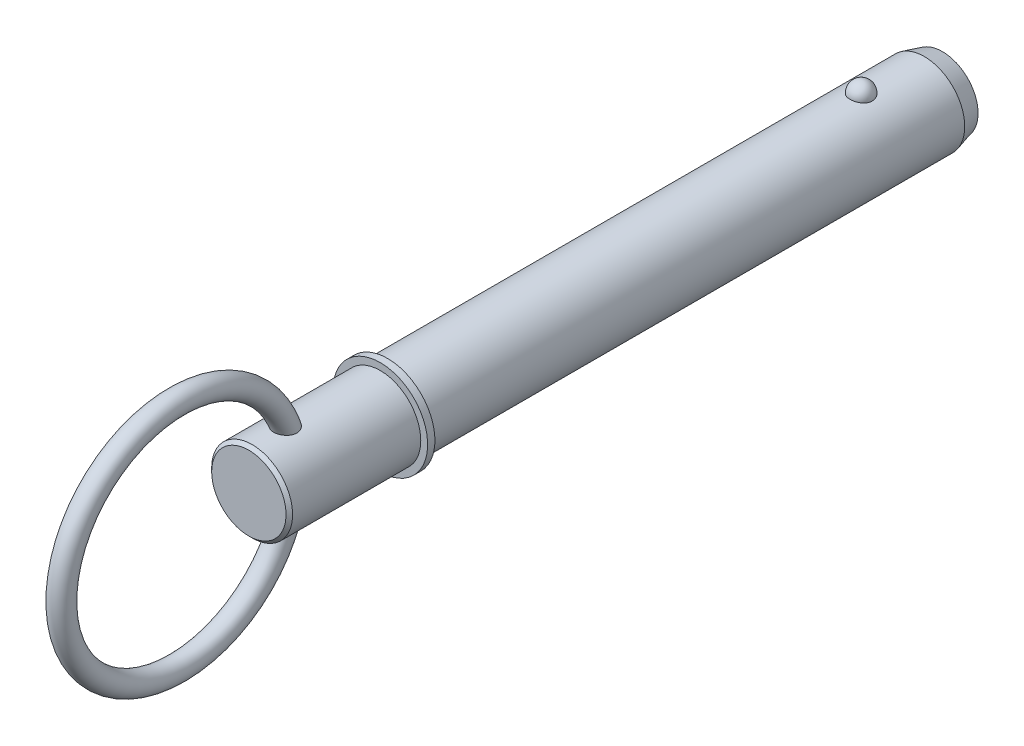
SolidWorks part; units mm, degrees
ref_plane "Front Plane" through (0, 0, 0) normal (0, 0, 1) x (1, 0, 0)
ref_plane "Top Plane" through (0, 0, 0) normal (0, 1, 0) x (1, 0, 0)
ref_plane "Right Plane" through (0, 0, 0) normal (1, 0, 0) x (0, 0, -1)
sketch "Sketch2" plane through (0, 0, 0) normal (0, 0, 1) x (1, 0, 0)
  circle A0 centre (0, 0) radius 11.115
  point P3 (0, 11.115)
  dimension "D1" = 22.23
extrude "Boss-Extrude1" add sketch "Sketch2" along normal blind 127
sketch "Sketch3" plane through (0, 0, 0) normal (0, 0, -1) x (-1, 0, 0)
  circle A0 centre (0, 0) radius 11.115
  dimension "D1" = 22.23
extrude "Boss-Extrude2" add sketch "Sketch3" along normal blind 25.4
chamfer "Chamfer1" distance 5 angle 15 1 edges at (-11.115, 0, -25.4)
sketch "Sketch18" plane through (0, 0, 0) normal (1, 0, 0) x (0, 0, -1)
  line L0 (20.4, 11.115) -> (-127, 11.115) construction
  line L1 (3.07, 14.185) -> (3.07, 8.045)
  line L2 (-127, -11.115) -> (20.4, -11.115) construction
  arc A0 (3.07, 14.185) -> (3.07, 8.045) centre (3.07, 11.115) ccw
  point P4 (0, 11.115)
  dimension "D1" = 25.3
revolve "Revolve1" add sketch "Sketch18" angle 360 about L1
sketch "Sketch19" plane through (0, 0, 0) normal (1, 0, 0) x (0, 0, -1)
  line L0 (-33.7288, 0) -> (-46.4542, 0) construction
sketch "Sketch20" plane through (0, 0, 0) normal (1, 0, 0) x (0, 0, -1)
  line L0 (-127, 0) -> (-127, 13)
  line L1 (-127, 11.115) -> (-127, -11.115) construction
  line L2 (-127, 13) -> (-129, 13)
  line L3 (-129, 13) -> (-129, 0)
  line L4 (-33.7288, 0) -> (-46.4542, 0) construction
  line L5 (-129, 0) -> (-127, 0)
  dimension "D1" = 13
  dimension "D2" = 2
revolve "Revolve2" add sketch "Sketch20" angle 360 about L0
sketch "Sketch21" plane through (0, 0, 127) normal (0, 0, -1) x (-1, 0, 0)
  circle A0 centre (0, 0) radius 11.115
  dimension "D1" = 22.23
extrude "Boss-Extrude3" add sketch "Sketch21" against normal blind 38.1
chamfer "Chamfer2" distance 0.9 angle 45 1 edges at (-11.115, 0, 165.1)
sketch "Sketch23" plane through (0, 0, 0) normal (1, 0, 0) x (0, 0, -1)
  line L0 (-165.1, 10.215) -> (-165.1, -10.215) construction
  circle A0 centre (-184.85, 0) radius 31.75
  point P2 (-153.1, 0)
  dimension "D1" = 63.5
  dimension "D2" = 12
sketch "Sketch24" plane through (0, 0, 0) normal (0, 1, 0) x (1, 0, 0)
  circle A0 centre (0, -153.1) radius 3
  dimension "D1" = 6
sweep "Sweep1" add profiles "Sketch24" path "Sketch23"
